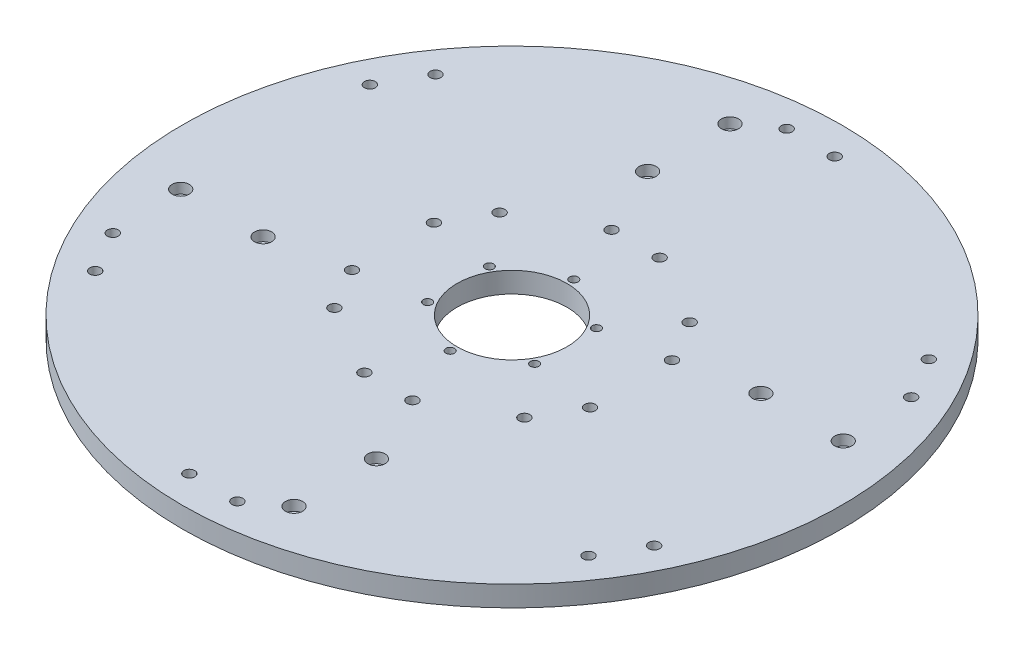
SolidWorks part; units mm, degrees
ref_plane "Front Plane" through (0, 0, 0) normal (0, 0, 1) x (1, 0, 0)
ref_plane "Top Plane" through (0, 0, 0) normal (0, 1, 0) x (1, 0, 0)
ref_plane "Right Plane" through (0, 0, 0) normal (1, 0, 0) x (0, 0, -1)
sketch "Sketch1" plane through (0, 0, 0) normal (0, 1, 0) x (1, 0, 0)
  circle A0 centre (0, 0) radius 304.8
  circle A1 centre (0, 0) radius 50.8
  dimension "D1" = 609.6
  dimension "D2" = 101.6
extrude "Extrude1" add sketch "Sketch1" along normal blind 19.05
hole_wizard "CBORE for 3/8 Socket Head Cap Screw1" positions "Sketch3" profile "Sketch2" counterbore size "3/8" standard "Example Inch"
sketch "Sketch3" plane through (108.7297, 0, -101.906) normal (0, 1, 0) x (-1, 0, 0)
  line L0 (108.7297, 101.906) -> (108.7297, 242.127) construction
  line L1 (-30.4169, 297.1685) -> (22.225, 297.1685) construction
  point P0 (86.5047, 216.206)
  point P1 (130.9547, 378.131)
  point P3 (86.5047, 378.131)
  point P5 (130.9547, 216.206)
  dimension "D1" = 161.925
  dimension "D2" = 44.45
  dimension "D3" = 114.3
sketch "Sketch2" plane through (22.225, 0, 114.3) normal (1, 0, 0) x (0, 0, -1)
  line L0 (0, 0) -> (0, 19.05)
  line L1 (0, 19.05) -> (5.0419, 19.05)
  line L3 (5.0419, 19.05) -> (5.0419, 9.525)
  line L4 (5.0419, 9.525) -> (7.9375, 9.525)
  line L5 (7.9375, 9.525) -> (7.9375, 0)
  line L7 (7.9375, 0) -> (0, 0)
  line L11 (0, -6.35) -> (0, 107.95) construction
  dimension "Thru Hole Dia." = 10.0838
  dimension "Thru Hole Depth" = 19.05
  dimension "C'Bore Dia." = 15.875
  dimension "C'Bore Depth" = 9.525
pattern_circular "CirPattern1" count 6 over 360 about axis through (0, 0, 0) along (0, 1, 0) of "CBORE for 3/8 Socket Head Cap Screw1"
hole_wizard "CBORE for 3/8 Socket Head Cap Screw2" positions "Sketch5" profile "Sketch4" counterbore size "3/8" standard "Example Inch"
sketch "Sketch5" plane through (0, 19.05, 0) normal (0, 1, 0) x (-1, 0, 0)
  point P0 (-177.8, -52.3875)
  point P1 (-254, -52.3875)
  dimension "D1" = 76.2
  dimension "D2" = 177.8
  dimension "D3" = 52.3875
sketch "Sketch4" plane through (177.8, 19.05, -52.3875) normal (1, 0, 0) x (0, 0, 1)
  line L0 (0, 0) -> (0, 19.05)
  line L1 (0, 19.05) -> (5.0419, 19.05)
  line L3 (5.0419, 19.05) -> (5.0419, 9.525)
  line L4 (5.0419, 9.525) -> (7.9375, 9.525)
  line L5 (7.9375, 9.525) -> (7.9375, 0)
  line L7 (7.9375, 0) -> (0, 0)
  line L11 (0, -6.35) -> (0, 107.95) construction
  dimension "Thru Hole Dia." = 10.0838
  dimension "Thru Hole Depth" = 19.05
  dimension "C'Bore Dia." = 15.875
  dimension "C'Bore Depth" = 9.525
pattern_circular "CirPattern2" count 4 over 360 about axis through (0, 0, 0) along (0, 1, 0) of "CBORE for 3/8 Socket Head Cap Screw2"
hole_wizard "5/16 (0.3125) Diameter Hole1" positions "Sketch7" profile "Sketch6" hole size "5/16" standard "Example Inch"
sketch "Sketch7" plane through (0, 19.05, 0) normal (0, 1, 0) x (-1, 0, 0)
  point P0 (0, -57.15)
  dimension "D1" = 57.15
sketch "Sketch6" plane through (0, 19.05, -57.15) normal (1, 0, 0) x (0, 0, 1)
  line L0 (0, 0) -> (0, 19.05)
  line L1 (0, 19.05) -> (3.9687, 19.05)
  line L2 (3.9687, 19.05) -> (3.9687, 0)
  line L5 (3.9687, 0) -> (0, 0)
  line L11 (0, -6.35) -> (0, 107.95) construction
  dimension "Thru Hole Dia." = 7.9375
  dimension "Thru Hole Depth" = 19.05
pattern_circular "CirPattern3" count 6 over 360 about axis through (0, 0, 0) along (0, 1, 0) of "5/16 (0.3125) Diameter Hole1"
hole_wizard "M5x0.8 Tapped Hole1" positions "Sketch9" profile "Sketch8" tap size "M5x0.8" standard "Ansi Metric"
sketch "Sketch9" plane through (0, 0, 0) normal (0, -1, 0) x (1, 0, 0)
  line L0 (-196.85, -177.8) -> (-112.4125, -129.05) construction
  line L2 (-112.4125, -129.05) -> (-160.4125, -45.9116) construction
  line L4 (-196.85, -177.8) -> (-244.85, -94.6616) construction
  line L6 (-196.85, -177.8) -> (-196.85, -142.051) construction
  circle A0 centre (0, 0) radius 50.8 construction
  point P0 (-196.85, -177.8)
  point P1 (-112.4125, -129.05)
  point P3 (-160.4125, -45.9116)
  point P5 (-244.85, -94.6616)
  dimension "D4" = 177.8
  dimension "D1" = 96
  dimension "D2" = 97.5
  dimension "D3" = 196.85
  dimension "D5" = 60
sketch "Sketch8" plane through (-196.85, 0, -177.8) normal (1, 0, 0) x (0, 0, -1)
  line L0 (0, 0) -> (0, 15.2318)
  line L1 (0, 15.2318) -> (2.1, 13.97)
  line L2 (2.1, 13.97) -> (2.1, 0)
  line L5 (2.1, 0) -> (0, 0)
  line L10 (0, 15.2318) -> (-2.1, 13.97) construction
  line L11 (0, -6.35) -> (0, 107.95) construction
  dimension "Tap Drill Dia." = 4.2
  dimension "Tap Drill Depth" = 13.97
  dimension "Drill Angle" = 118
